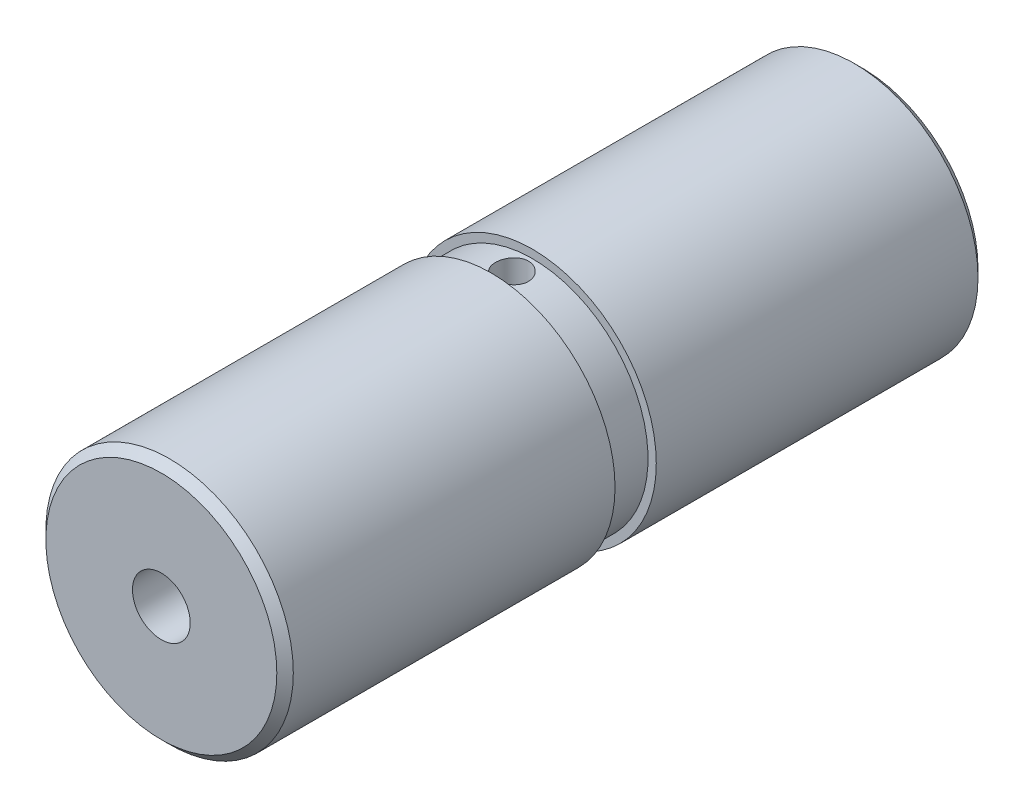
SolidWorks part; units mm, degrees
ref_plane "Piano frontale" through (0, 0, 0) normal (0, 0, 1) x (1, 0, 0)
ref_plane "Piano superiore" through (0, 0, 0) normal (0, 1, 0) x (1, 0, 0)
ref_plane "Piano destro" through (0, 0, 0) normal (1, 0, 0) x (0, 0, -1)
sketch "Schizzo1" plane through (0, 0, 0) normal (0, 0, 1) x (1, 0, 0)
  circle A0 centre (0, 0) radius 15
  dimension "D1" = 30
extrude "Estrusione1" add sketch "Schizzo1" against normal blind 85
chamfer "Smusso1" distance 1 angle 45 2 edges at (15, 0, -85) (15, 0, 0)
hole_wizard "Ø4.0 (4) Foro diametrale1" positions "Schizzo3" profile "Schizzo2" hole size "Ø4.0" standard "ISO"
sketch "Schizzo3" plane through (0, 0, 0) normal (0, 0, 1) x (1, 0, 0)
  point P0 (0, 0)
sketch "Schizzo2" plane through (0, 0, 0) normal (1, 0, 0) x (0, -1, 0)
  line L0 (0, 0) -> (0, 85)
  line L1 (0, 85) -> (2, 85)
  line L2 (2, 85) -> (2, 0)
  line L5 (2, 0) -> (0, 0)
  line L11 (0, -6.35) -> (0, 107.95) construction
  dimension "Thru Hole Dia." = 4
  dimension "Thru Hole Depth" = 85
hole_wizard "M8x1.0 Foro filettato profondo1" positions "Schizzo5" profile "Schizzo4" tap size "M8x1.0" standard "ISO"
sketch "Schizzo5" plane through (0, 0, 0) normal (0, 0, 1) x (1, 0, 0)
  point P0 (0, 0)
sketch "Schizzo4" plane through (0, 0, 0) normal (1, 0, 0) x (0, -1, 0)
  line L0 (0, 0) -> (0, 23.103)
  line L1 (0, 23.103) -> (3.5, 21)
  line L2 (3.5, 21) -> (3.5, 0)
  line L5 (3.5, 0) -> (0, 0)
  line L10 (0, 23.103) -> (-3.5, 21) construction
  line L11 (0, -6.35) -> (0, 107.95) construction
  dimension "Tap Drill Dia." = 7
  dimension "Tap Drill Depth" = 21
  dimension "Drill Angle" = 118
hole_wizard "M8x1.0 Foro filettato profondo2" positions "Schizzo7" profile "Schizzo6" tap size "M8x1.0" standard "ISO"
sketch "Schizzo7" plane through (0, 0, -85) normal (0, 0, -1) x (-1, 0, 0)
  point P0 (0, 0)
sketch "Schizzo6" plane through (0, 0, -85) normal (1, 0, 0) x (0, 1, 0)
  line L0 (0, 0) -> (0, 23.103)
  line L1 (0, 23.103) -> (3.5, 21)
  line L2 (3.5, 21) -> (3.5, 0)
  line L5 (3.5, 0) -> (0, 0)
  line L10 (0, 23.103) -> (-3.5, 21) construction
  line L11 (0, -6.35) -> (0, 107.95) construction
  dimension "Tap Drill Dia." = 7
  dimension "Tap Drill Depth" = 21
  dimension "Drill Angle" = 118
hole_wizard "Ø4.0 (4) Foro diametrale2" positions "Schizzo9" profile "Schizzo8" hole size "Ø4.0" standard "ISO"
sketch "Schizzo9" plane through (0, 0, 0) normal (0, 1, 0) x (1, 0, 0)
  line L0 (0, 84) -> (0, 1) construction
  point P0 (0, 42.5)
  dimension "D1" = 42.5
sketch "Schizzo8" plane through (0, 0, -42.5) normal (1, 0, 0) x (0, 0, -1)
  line L0 (0, 0) -> (0, 15)
  line L1 (0, 15) -> (2, 15)
  line L2 (2, 15) -> (2, 0)
  line L5 (2, 0) -> (0, 0)
  line L11 (0, -6.35) -> (0, 107.95) construction
  dimension "Thru Hole Dia." = 4
  dimension "Thru Hole Depth" = 15
sketch "Schizzo10" plane through (0, 0, 0) normal (0, 1, 0) x (1, 0, 0)
  line L0 (15, 1) -> (15, 84) construction
  line L1 (15, 45) -> (14, 45)
  line L2 (15, 45) -> (15, 40)
  line L3 (15, 40) -> (14, 40)
  line L4 (14, 45) -> (14, 40)
  dimension "D1" = 1
  dimension "D2" = 5
  dimension "D3" = 40
revolve "Taglia-Rivoluzione1" cut sketch "Schizzo10" angle 360 about axis through (0, 0, -85) along (0, 0, 1)
